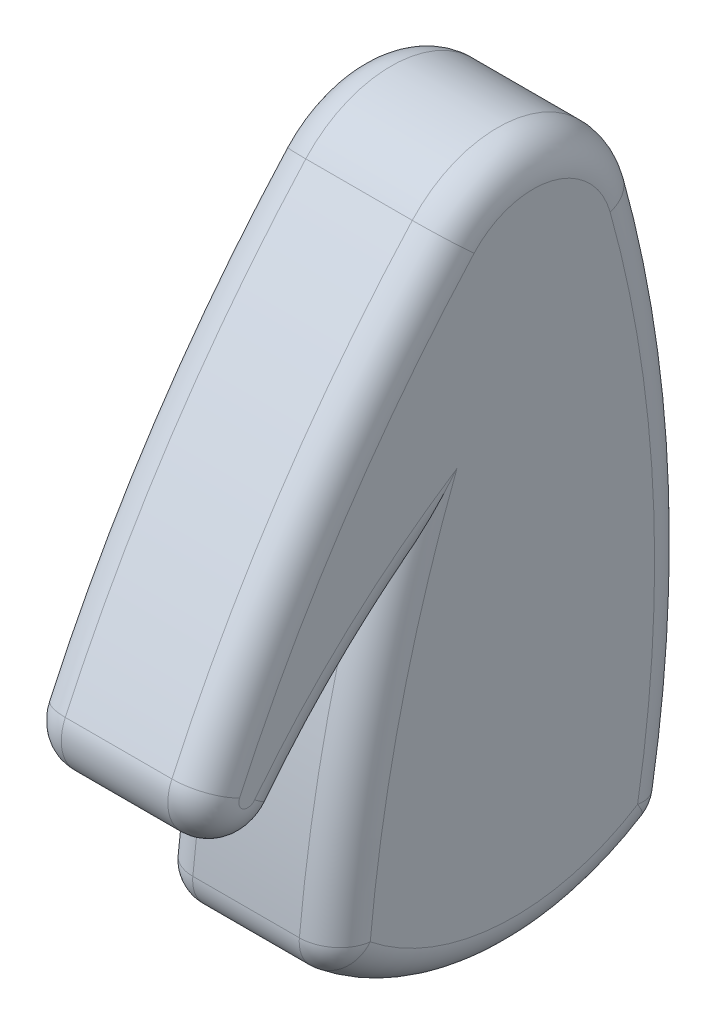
SolidWorks part; units mm, degrees
ref_plane "XY" through (0, 0, 0) normal (0, 0, 1) x (1, 0, 0)
ref_plane "YZ" through (0, 0, 0) normal (0, 1, 0) x (1, 0, 0)
ref_plane "XZ" through (0, 0, 0) normal (1, 0, 0) x (0, 0, -1)
ref_plane "Arm-plane" through (254, 0, 0) normal (1, 0, 0) x (0, 0, -1)
sketch "Sketch10" plane through (254, 0, 0) normal (1, 0, 0) x (0, 0, -1)
  line L0 (14.6537, -451.8825) -> (20.081, -363.1483) construction
  line L1 (0, 432.2232) -> (0, -432.2232) construction
  arc A0 (51.8841, -354.2667) -> (-4.3391, -340.9226) centre (20.081, -363.1483) ccw
  arc A1 (-4.3391, -340.9226) -> (-73.1292, -444.9241) centre (296.2149, -614.4701) ccw
  arc A2 (51.8841, -354.2667) -> (59.2236, -513.6883) centre (-290.611, -449.9144) cw
  arc A3 (59.2236, -513.6883) -> (-37.1164, -507.7958) centre (14.6537, -451.8825) cw
  arc A4 (-37.1164, -507.7958) -> (-21.9767, -426.6904) centre (367.8893, -541.4311) cw
  arc A5 (-73.1292, -444.9241) -> (-51.5724, -458.0323) centre (-61.5872, -450.2224) ccw
  arc A6 (-51.5724, -458.0323) -> (-21.9767, -426.6904) centre (128.6934, -598.6104) cw
  dimension "D1" = 33.02
  dimension "D2" = 355.6
  dimension "D3" = 165.1
  dimension "D6" = 406.4
  dimension "D8" = 12.7
  dimension "D9" = 228.6
  dimension "D11" = 406.4
  dimension "D4" = 76.2
  dimension "D5" = 3.5
  dimension "D7" = 119.38
  dimension "D10" = 76.2
  dimension "D12" = 48.26
  dimension "D13" = 48.26
  dimension "D14" = 76.2
  dimension "D15" = 38.1
extrude "Base-Extrude" add sketch "Sketch10" along normal mid plane 50.8
fillet "Fillet1" radius 10.16 2 edges at (254, -513.6883, -59.2236) (254, -507.7958, 37.1164)
fillet "Fillet2" radius 10.16 18 edges at (279.4, -441.6622, 37.515) (279.4, -464.263, 31.117) (228.6, -431.3808, -64.5057) (279.4, -431.3808, -64.5057) (228.6, -527.9688, -10.4922) (279.4, -331.0208, -27.7062) (228.6, -507.4704, 35.8865) (228.6, -513.3208, -58.4203) (279.4, -527.9688, -10.4922) (279.4, -507.4704, 35.8865) (279.4, -513.3208, -58.4203) (279.4, -390.2693, 42.7466) (228.6, -331.0208, -27.7062) (279.4, -461.0737, 68.1856) (228.6, -464.263, 31.117) (228.6, -441.6622, 37.515) (228.6, -461.0737, 68.1856) (228.6, -390.2693, 42.7466)
